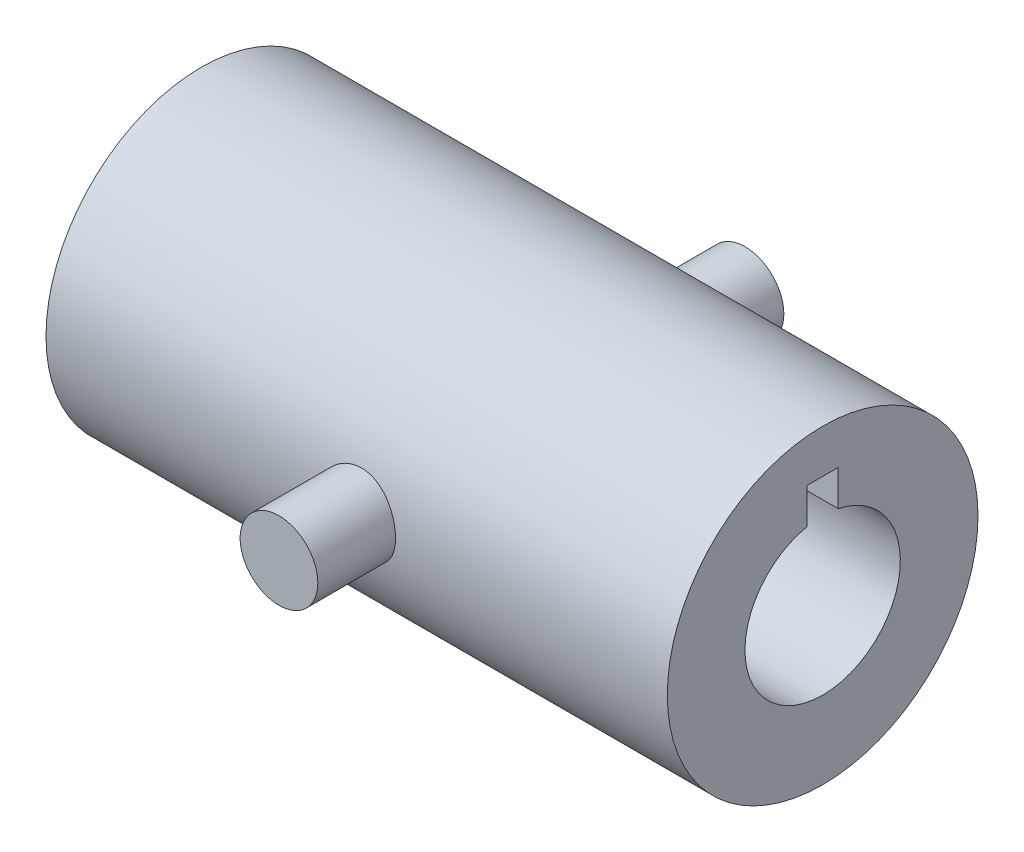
SolidWorks part; units mm, degrees
ref_plane "Plane1" through (0, 0, 0) normal (0, 0, 1) x (1, 0, 0)
ref_plane "Plane2" through (0, 0, 0) normal (0, 1, 0) x (1, 0, 0)
ref_plane "Plane3" through (0, 0, 0) normal (1, 0, 0) x (0, 0, -1)
imported_body "Imported1"
sketch "Sketch1" plane through (0.0003, 0.0001, -4.562) normal (-0.0001, 0, 1) x (1, 0, 0.0001)
  circle A0 centre (12909.2894, 5713.1853) radius 3.175 construction
  point P0 (12909.2894, 5713.1853)
sketch "Sketch2" plane through (12882.1086, -4.0126, 0.7311) normal (-1, 0.0003, -0.0001) x (-0.0001, 0, 1)
  circle A0 centre (-23.5041, 5717.2065) radius 6.35
extrude "Cut-Extrude1" cut sketch "Sketch2" against normal through all
